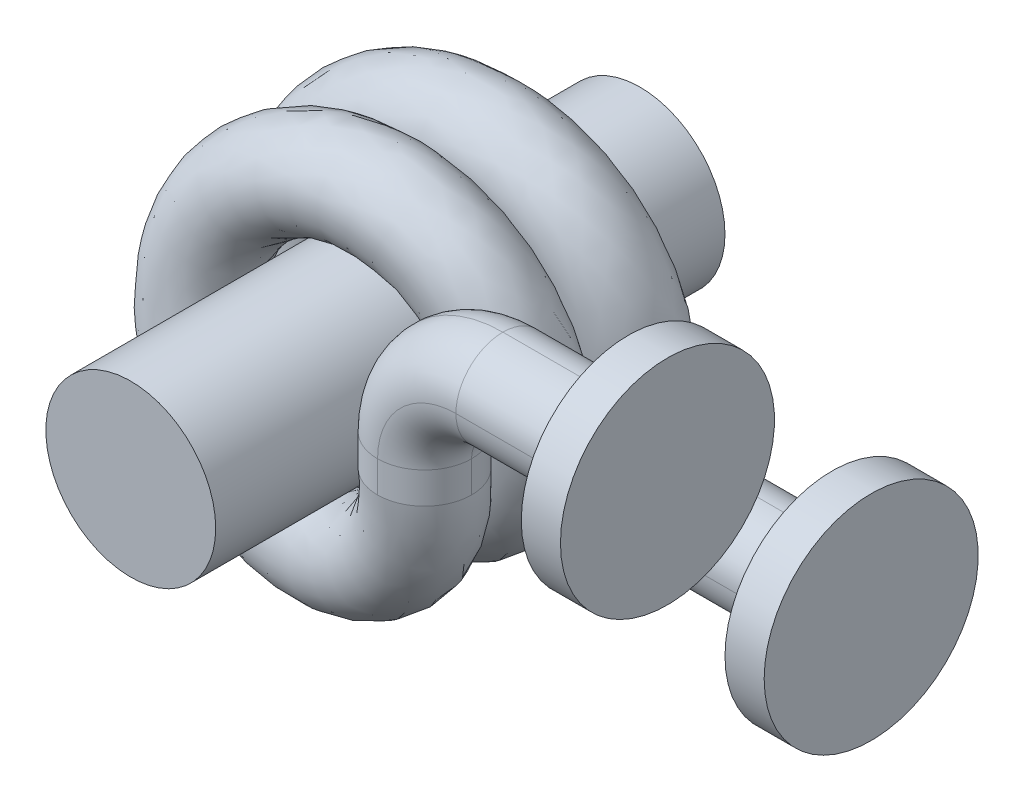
SolidWorks part; units mm, degrees
other "<coil>-<Boss-Extrude6>"
other "<coil>-<Boss-Extrude5>"
ref_plane "Front Plane" through (0, 0, 0) normal (0, 0, 1) x (1, 0, 0)
ref_plane "Top Plane" through (0, 0, 0) normal (0, 1, 0) x (1, 0, 0)
ref_plane "Right Plane" through (0, 0, 0) normal (1, 0, 0) x (0, 0, -1)
mirrored part "coil_Mirrored"
